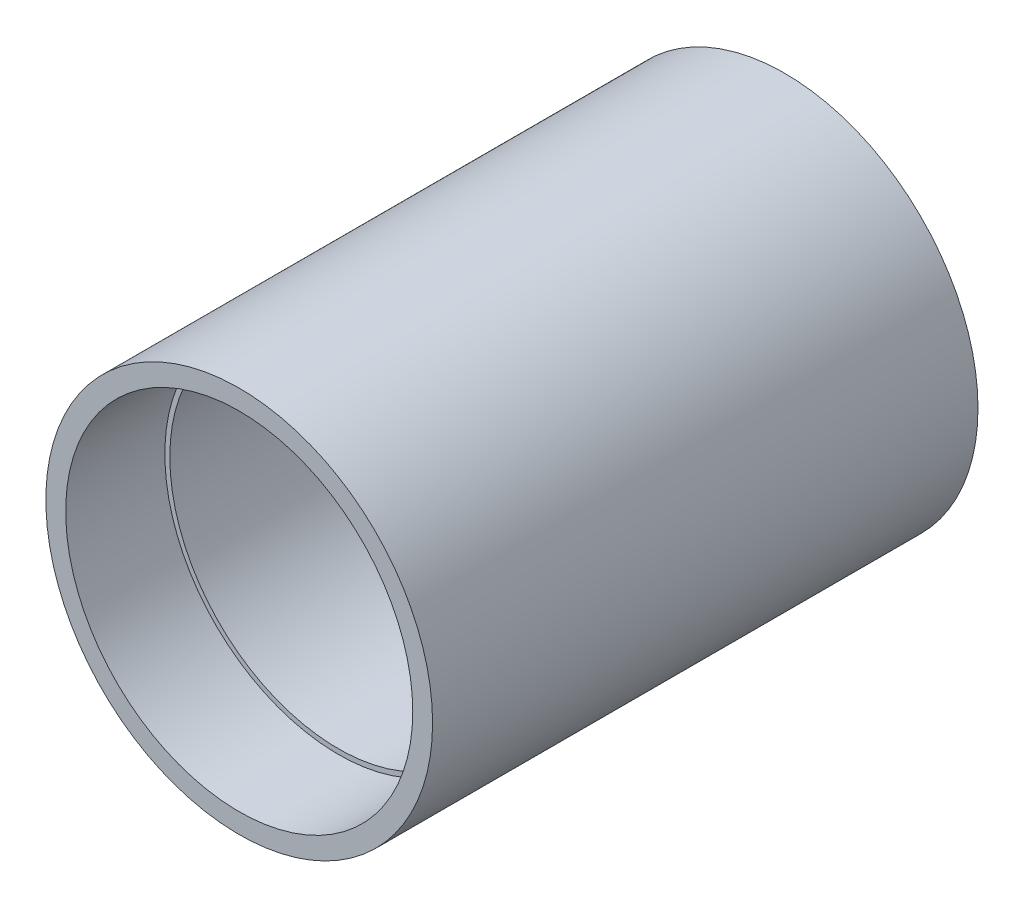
SolidWorks part; units mm, degrees
ref_plane "Plan de face" through (0, 0, 0) normal (0, 0, 1) x (1, 0, 0)
ref_plane "Plan de dessus" through (0, 0, 0) normal (0, 1, 0) x (1, 0, 0)
ref_plane "Plan de droite" through (0, 0, 0) normal (1, 0, 0) x (0, 0, -1)
sketch "Esquisse1" plane through (0, 0, 0) normal (0, 0, 1) x (1, 0, 0)
  circle A0 centre (0, 0) radius 17
  circle A1 centre (0, 0) radius 19.5
  dimension "D1" = 34
  dimension "D2" = 39
extrude "Extrusion1" add sketch "Esquisse1" along normal blind 55
sketch "Esquisse2" plane through (0, 0, 55) normal (0, 0, 1) x (1, 0, 0)
  circle A0 centre (0, 0) radius 17.5
  dimension "D1" = 35
extrude "Enlèv. mat.-Extru.1" cut sketch "Esquisse2" against normal blind 10
sketch "Esquisse3" plane through (0, 0, 0) normal (0, 0, -1) x (-1, 0, 0)
  circle A0 centre (0, 0) radius 17.5
  dimension "D1" = 35
extrude "Enlèv. mat.-Extru.2" cut sketch "Esquisse3" against normal blind 10
